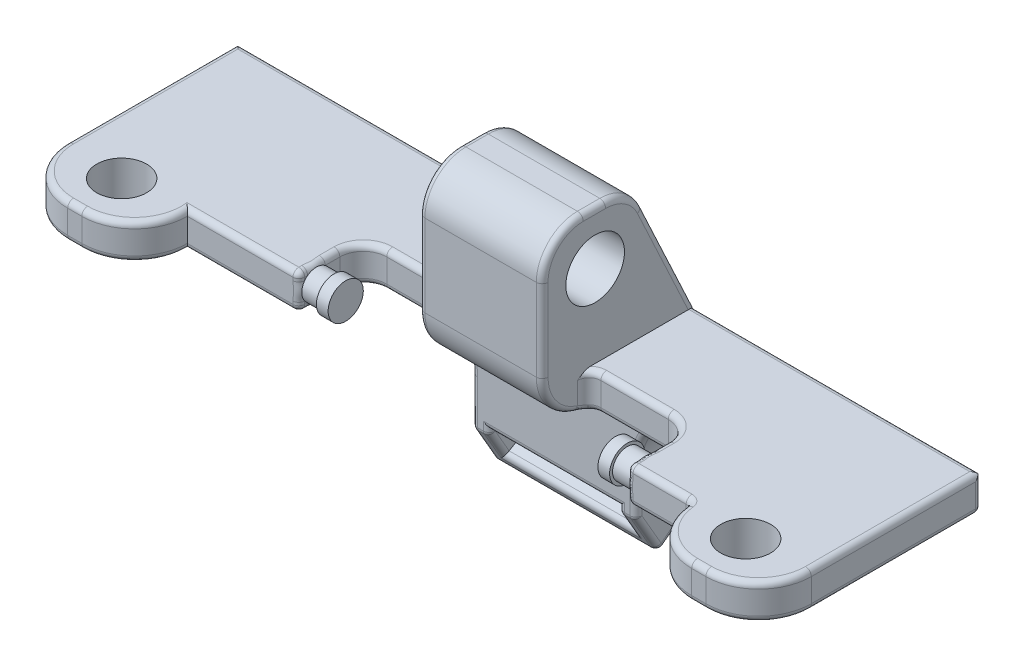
SolidWorks part; units mm, degrees
ref_plane "Front Plane" through (0, 0, 0) normal (0, 0, 1) x (1, 0, 0)
ref_plane "Top Plane" through (0, 0, 0) normal (0, 1, 0) x (1, 0, 0)
ref_plane "Right Plane" through (0, 0, 0) normal (1, 0, 0) x (0, 0, -1)
sketch "Sketch1" plane through (0, 0, 0) normal (0, 1, 0) x (1, 0, 0)
  line L0 (0, 19) -> (0, -19) construction
  line L1 (-63.4, 19) -> (63.4, 19)
  line L2 (-63.4, 19) -> (-63.4, -19)
  line L3 (-63.4, -19) -> (-43, -19)
  line L4 (63.4, 19) -> (63.4, -19)
  line L5 (-63.4, 19) -> (63.4, -19) construction
  line L6 (-63.4, -19) -> (63.4, 19) construction
  line L7 (-43, -19) -> (-43, 1)
  line L8 (-43, 1) -> (43, 1)
  line L9 (43, -19) -> (43, 1)
  line L10 (43, -19) -> (63.4, -19)
  circle A0 centre (-53.2, -11) radius 4.25
  circle A1 centre (53.2, -11) radius 4.25
  point P0 (0, 0)
  point P16 (0, 1)
  dimension "D3" = 8.5
  dimension "D1" = 126.8
  dimension "D2" = 38
  dimension "D4" = 30
  dimension "D5" = 10.2
  dimension "D6" = 10.2
  dimension "D7" = 20
extrude "Boss-Extrude1" add sketch "Sketch1" along normal blind 6
sketch "Sketch2" plane through (0, 0, 0) normal (0, -1, 0) x (1, 0, 0)
  line L0 (63.4, -19) -> (-63.4, -19) construction
  line L1 (-10.5, -19) -> (17.5, -19)
  line L2 (-10.5, -19) -> (-10.5, -6)
  line L3 (-10.5, -6) -> (17.5, -6)
  line L4 (17.5, -19) -> (17.5, -6)
  dimension "D1" = 52.9
  dimension "D2" = 45.9
  dimension "D3" = 13
extrude "Boss-Extrude2" add sketch "Sketch2" along normal blind 17.73
sketch "Sketch3" plane through (17.5, 0, 0) normal (1, 0, 0) x (0, 0, -1)
  line L0 (6, -17.73) -> (10, -24.6582)
  line L1 (10, -24.6582) -> (19, -17.73)
  line L2 (19, -17.73) -> (6, -17.73)
  dimension "D1" = 60
  dimension "D2" = 8
extrude "Boss-Extrude3" add sketch "Sketch3" against normal up to surface (28 mm away)
sketch "Sketch4" plane through (0, -1.8344, 3.1773) normal (0, -0.5, 0.866) x (1, 0, 0)
  line L0 (17.5, -18.3546) -> (-10.5, -18.3546) construction
  line L1 (-7.5, -18.3546) -> (14.5, -18.3546)
  line L2 (-7.5, -18.3546) -> (-7.5, -23.3546)
  line L3 (-7.5, -23.3546) -> (14.5, -23.3546)
  line L4 (14.5, -18.3546) -> (14.5, -23.3546)
  line L5 (-10.5, -26.3546) -> (-10.5, -18.3546) construction
  line L6 (17.5, -18.3546) -> (17.5, -26.3546) construction
  line L7 (-10.5, -26.3546) -> (17.5, -26.3546) construction
  dimension "D1" = 3
  dimension "D2" = 3
  dimension "D3" = 3
extrude "Cut-Extrude1" cut sketch "Sketch4" against normal through all
sketch "Sketch5" plane through (0, 6, 0) normal (0, 1, 0) x (1, 0, 0)
  line L0 (4, 19) -> (4, 1) construction
  line L1 (63.4, 19) -> (-63.4, 19) construction
  line L2 (-43, 1) -> (43, 1) construction
  line L3 (8, 19) -> (14.5, 19)
  line L5 (8, 19) -> (0, 19)
  line L7 (14.5, 19) -> (14.5, -7)
  line L10 (14.5, -7) -> (-6.5, -7)
  line L12 (-6.5, 19) -> (-6.5, -7)
  line L13 (0, 19) -> (-6.5, 19)
  point P12 (3.5, -11)
  point P19 (4, -1.26)
  dimension "D1" = 48.9
  dimension "D2" = 4
  dimension "D3" = 26
  dimension "D4" = 10.5
extrude "Boss-Extrude4" add sketch "Sketch5" along normal blind 23
sketch "Sketch7" plane through (14.5, 0, 0) normal (1, 0, 0) x (0, 0, -1)
  circle A0 centre (2.0294, 20) radius 5
  dimension "D1" = 10
  dimension "D2" = 14
  dimension "D3" = 22
extrude "Cut-Extrude3" cut sketch "Sketch7" against normal through all both and the other way through all
sketch "Sketch10" plane through (14.5, 0, 0) normal (1, 0, 0) x (0, 0, -1)
  line L0 (19, 6) -> (8.2749, 29)
  line L1 (-7, 29) -> (19, 29) construction
  line L2 (8.2749, 29) -> (19, 29)
  line L3 (19, 29) -> (19, 6)
  dimension "D1" = 25
extrude "Cut-Extrude5" cut sketch "Sketch10" against normal through all
fillet "Fillet2" radius 7 1 edges at (4, 29, 7)
fillet "Fillet3" radius 7 1 edges at (4, 29, -8.2749)
fillet "Fillet4" radius 9 4 edges at (-63.4, 3, 19) (-43, 3, 19) (43, 3, 19) (63.4, 3, 19)
fillet "Fillet5" radius 10 2 edges
sketch "Sketch11" plane through (0, 6, 0) normal (0, -1, 0) x (1, 0, 0)
  line L1 (-6.5, -1) -> (14.5, -1)
  line L2 (-6.5, -1) -> (-6.5, 7)
  line L3 (-6.5, 7) -> (14.5, 7)
  line L4 (14.5, -1) -> (14.5, 7)
extrude "Boss-Extrude5" add sketch "Sketch11" along normal up to surface (6 mm away)
sketch "Sketch17" plane through (0, 0, -1) normal (0, 0, 1) x (1, 0, 0)
  line L0 (14.5, 0) -> (43, 0) construction
  line L1 (43, 6) -> (32, 6)
  line L2 (43, 6) -> (43, 0)
  line L3 (43, 0) -> (32, 0)
  line L4 (32, 6) -> (32, 0)
  line L5 (-43, 0) -> (-6.5, 0) construction
  line L6 (-43, 6) -> (-24, 6)
  line L7 (-43, 6) -> (-43, 0)
  line L8 (-43, 0) -> (-24, 0)
  line L9 (-24, 6) -> (-24, 0)
  dimension "D1" = 17.5
  dimension "D2" = 17.5
extrude "Boss-Extrude10" add sketch "Sketch17" along normal blind 11
sketch "Sketch18" plane through (32, 0, 0) normal (-1, 0, 0) x (0, 0, 1)
  circle A0 centre (7, 3) radius 2.5
  dimension "D1" = 5
  dimension "D2" = 3
  dimension "D3" = 3
extrude "Boss-Extrude11" add sketch "Sketch18" along normal blind 3
sketch "Sketch19" plane through (29, 0, 0) normal (-1, 0, 0) x (0, 0, 1)
  circle A0 centre (7, 3) radius 3
  dimension "D1" = 6
extrude "Boss-Extrude12" add sketch "Sketch19" along normal blind 2
sketch "Sketch20" plane through (-24, 0, 0) normal (1, 0, 0) x (0, 0, -1)
  circle A0 centre (-7, 3) radius 2.5
  dimension "D1" = 5
  dimension "D2" = 3
  dimension "D3" = 3
extrude "Boss-Extrude13" add sketch "Sketch20" along normal blind 3
sketch "Sketch21" plane through (-21, 0, 0) normal (1, 0, 0) x (0, 0, -1)
  circle A0 centre (-7, 3) radius 3
  dimension "D1" = 6
extrude "Boss-Extrude14" add sketch "Sketch21" along normal blind 2
fillet "Fillet7" radius 4 2 edges at (32, 3, -1) (-24, 3, -1)
fillet "Fillet8" radius 8 1 edges at (4, 0, 7)
fillet "Fillet9" radius 2 2 edges at (14.5, 3, -1) (-6.5, 3, -1)
fillet "Fillet16" radius 1 11 edges at (17.5, -21.1941, -14.5) (-7.5, -13.1112, -19) (3.5, -10.2244, -19) (14.5, -13.1112, -19) (3.5, -15.9979, -19) (-10.5, -21.1941, -8) (17.5, -21.1941, -8) (3.5, -24.6582, -10) (14.5, -19.8951, -7.25) (-7.5, -19.8951, -7.25) (3.5, -22.0601, -8.5)
fillet "Fillet18" radius 1 10 edges at (3.5, -17.73, -6) (-9, -17.73, -6) (-10.2071, -17.1442, -6) (-10.5, -12.865, -6) (-13.4289, -2.9289, -6) (3.5, 0, -6) (20.4289, -2.9289, -6) (17.5, -12.865, -6) (17.2071, -17.1442, -6) (16, -17.73, -6)
fillet "Fillet19" radius 1 5 edges at (16, -17.73, -19) (17.2071, -17.3604, -19) (20.4289, -2.9289, -19)
fillet "Fillet20" radius 1 6 edges at (-10.2071, -24.1351, -10.0362) (-10.5, -20.9959, -14.7575) (-10.5, -17.6794, -18.8972) (-13.4289, -2.9289, -19)
fillet "Fillet21" radius 1 13 edges at (37.5, 6, 10) (63.4, 3.5, -19) (63.4, 0.2929, -18.7071) (63.4, 0, -4) (60.764, 6, 16.364) (60.764, 0, 16.364) (53.2, 6, 19) (53.2, 0, 19) (63.4, 6, -4.5) (45.636, 6, 16.364) (45.636, 0, 16.364) (43, 3, 10) (37.5, 0, 10)
fillet "Fillet22" radius 1 12 edges at (-45.636, 6, 16.364) (-53.2, 6, 19) (-60.764, 6, 16.364) (-63.4, 0.2929, -18.7071) (-63.4, 0, -4) (-60.764, 0, 16.364) (-53.2, 0, 19) (-33.5, 6, 10) (-45.636, 0, 16.364) (-33.5, 0, 10)
fillet "Fillet23" radius 1 2 edges
fillet "Fillet24" radius 1 39 edges at (14.5, 29, -1.9077) (14.5, 15, 7) (14.5, 26.9497, 4.9497) (-6.5, 15, 7) (-6.5, 26.9497, 4.9497) (14.5, 27.9037, -7.5765) (-6.5, 29, -1.9077) (-6.5, 27.9037, -7.5765) (-14.25, 6, -1) (30.8284, 0, 0.1716) (30.8284, 6, 0.1716) (-22.8284, 6, 0.1716) (-22.8284, 0, 0.1716) (14.5, 3.101, 5.3246) (22.25, 6, -1) (-6.5, 3.101, 5.3246) (15.0858, 6, -0.4142) (15.2512, 0.012, -0.5622) (-7.0858, 6, -0.4142) (-6.9245, 0.0369, -0.232) (32, 3, 10) (32, 6, 6) (32, 0, 6) (32, 0.2929, 9.7071) (32, 5.7071, 9.7071) (-24, 6, 6) (-24, 0, 6) (-24, 3, 10) (-24, 0.2929, 9.7071) (-24, 5.7071, 9.7071) (-6.5, 5.7071, -18.7071) (14.5, 5.7071, -18.7071)
